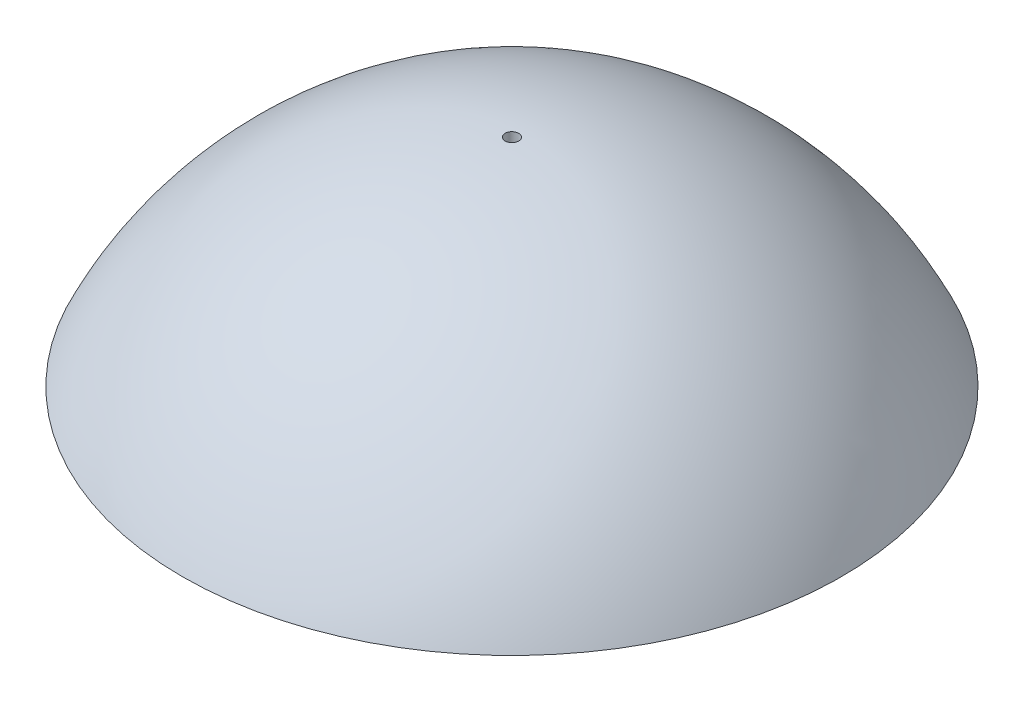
SolidWorks part; units mm, degrees
ref_plane "Front Plane" through (0, 0, 0) normal (0, 0, 1) x (1, 0, 0)
ref_plane "Top Plane" through (0, 0, 0) normal (0, 1, 0) x (1, 0, 0)
ref_plane "Right Plane" through (0, 0, 0) normal (1, 0, 0) x (0, 0, -1)
sketch "Sketch2" plane through (0, 0, 0) normal (1, 0, 0) x (0, 0, -1)
  line L4 (0, 0) -> (0, -82.7558) construction
  line L5 (0, 59.3848) -> (0, 56.2098)
  line L6 (-103.124, 0) -> (-99.3785, 0)
  arc A0 (0, 56.2098) -> (-99.3785, 0) centre (-0.8072, -58.3183) ccw
  arc A2 (-41.275, 34.4937) -> (-152.4, -112.2105) centre (0, -112.2105) ccw construction
  arc A3 (-103.124, 0) -> (-121.4827, -20.1903) centre (0, -112.2105) ccw
  spline S0 degree 3 poles (-121.4827, -20.1903) (-99.8898, 26.0046) (-52.5536, 59.8902) (0, 59.3848) knots 0 0 0 0 1 1 1 1
  dimension "D1" = 3.175
revolve "Revolve1" add sketch "Sketch2" angle 360 about L4
sketch "Sketch4" plane through (0, 0, 0) normal (0, -1, 0) x (1, 0, 0)
  circle A0 centre (0, 0) radius 2.4892
  dimension "D1" = 4.9784
extrude "Cut-Extrude2" cut sketch "Sketch4" against normal through all
sketch "Sketch5" plane through (0, 0, 0) normal (0, 0, 1) x (1, 0, 0)
  line L0 (0, 0) -> (0, 85.1281) construction
  line L2 (2.4892, 46.5827) -> (47.7925, 46.5827)
  line L3 (47.7925, 46.5827) -> (51.6412, 46.5827) construction
  line L4 (2.4892, 57.9235) -> (33.0953, 53.8023)
  line L5 (33.0953, 53.8023) -> (47.7925, 46.5827)
  line L6 (2.4892, 57.9235) -> (2.4892, 46.5827)
revolve "Revolve2" add sketch "Sketch5" angle 360 about L0
